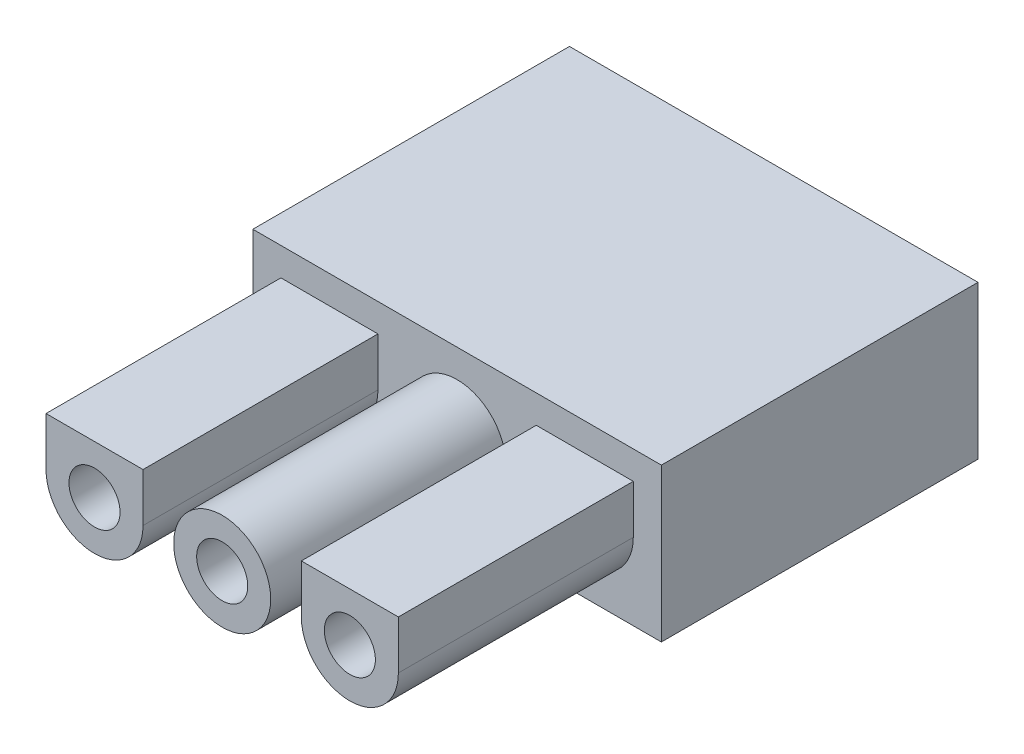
SolidWorks part; units mm, degrees
ref_plane "Plane1" through (0, 0, 0) normal (0, 0, 1) x (1, 0, 0)
ref_plane "Plane2" through (0, 0, 0) normal (0, 1, 0) x (1, 0, 0)
ref_plane "Plane3" through (0, 0, 0) normal (1, 0, 0) x (0, 0, -1)
sketch "Sketch1" plane through (0, 0, 0) normal (0, 0, 1) x (1, 0, 0)
  line L1 (0, 0) -> (20.32, 0)
  line L2 (0, 0) -> (0, -7.62)
  line L3 (0, -7.62) -> (20.32, -7.62)
  line L4 (20.32, 0) -> (20.32, -7.62)
  dimension "D1" = 7.62
  dimension "D2" = 20.32
extrude "Base-Extrude" add sketch "Sketch1" along normal blind 15.748
sketch "Sketch2" plane through (0, 0, 15.748) normal (0, 0, 1) x (1, 0, 0)
  line L0 (10.16, -3.81) -> (20.32, -3.81) construction
  line L3 (10.16, -3.81) -> (10.16, 0) construction
  line L4 (10.16, -3.81) -> (10.16, -7.62) construction
  line L5 (0, -7.62) -> (20.32, -7.62) construction
  line L6 (20.32, -7.62) -> (20.32, 0) construction
  line L7 (18.923, -3.81) -> (18.923, -1.397)
  line L8 (14.097, -3.81) -> (14.097, -1.397)
  line L9 (16.51, -1.397) -> (18.923, -1.397)
  line L10 (16.51, -1.397) -> (14.097, -1.397)
  line L11 (1.397, -3.81) -> (1.397, -1.397)
  line L12 (6.223, -3.81) -> (6.223, -1.397)
  line L13 (3.81, -1.397) -> (6.223, -1.397)
  line L14 (3.81, -1.397) -> (1.397, -1.397)
  circle A0 centre (10.16, -3.81) radius 2.413
  arc A1 (14.097, -3.81) -> (18.923, -3.81) centre (16.51, -3.81) ccw
  arc A2 (6.223, -3.81) -> (1.397, -3.81) centre (3.81, -3.81) cw
  dimension "D1" = 4.826
  dimension "D2" = 4.826
  dimension "D3" = 6.35
  dimension "D4" = 2.413
extrude "Boss-Extrude1" add sketch "Sketch2" along normal blind 11.684
sketch "Sketch3" plane through (0, 0, 0) normal (0, 0, -1) x (-1, 0, 0)
  circle A0 centre (-3.81, -3.81) radius 1.27
  circle A1 centre (-16.51, -3.81) radius 1.27
  circle A2 centre (-10.16, -3.81) radius 1.27
  dimension "D1" = 2.54
  dimension "D2" = 2.54
  dimension "D3" = 2.54
extrude "Cut-Extrude1" cut sketch "Sketch3" against normal through all
